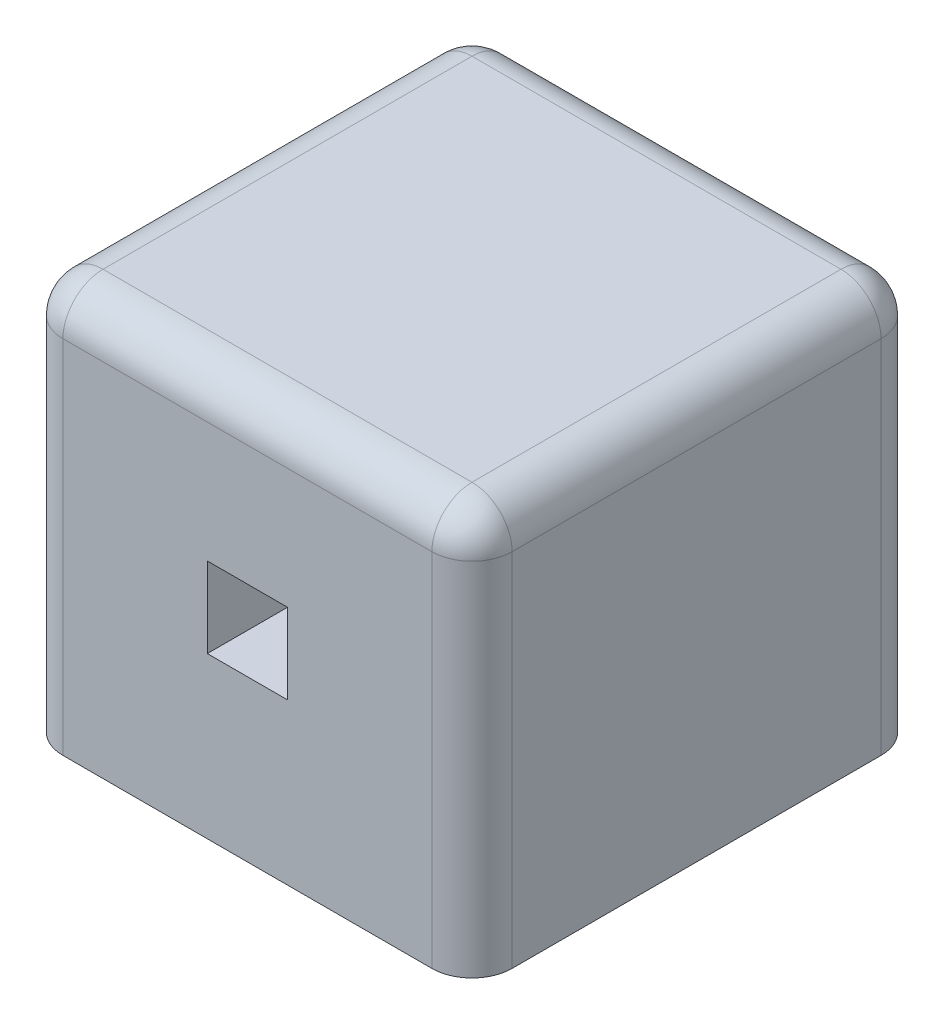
SolidWorks part; units mm, degrees
ref_plane "Front Plane" through (0, 0, 0) normal (0, 0, 1) x (1, 0, 0)
ref_plane "Top Plane" through (0, 0, 0) normal (0, 1, 0) x (1, 0, 0)
ref_plane "Right Plane" through (0, 0, 0) normal (1, 0, 0) x (0, 0, -1)
sketch "Sketch1" plane through (0, 0, 0) normal (0, 0, 1) x (1, 0, 0)
  line L0 (0, 35.7143) -> (0, -603.321) construction
  line L1 (40, -35.7143) -> (-40, -35.7143)
  line L2 (40, -35.7143) -> (40, 35.7143)
  line L3 (40, 35.7143) -> (-40, 35.7143)
  line L4 (-40, -35.7143) -> (-40, 35.7143)
  line L5 (40, -35.7143) -> (-40, 35.7143) construction
  line L6 (40, 35.7143) -> (-40, -35.7143) construction
  line L7 (-40, 0) -> (40, 0) construction
  line L9 (7.1429, -7.1429) -> (-7.1429, -7.1429)
  line L10 (7.1429, -7.1429) -> (7.1429, 7.1429)
  line L11 (7.1429, 7.1429) -> (-7.1429, 7.1429)
  line L12 (-7.1429, -7.1429) -> (-7.1429, 7.1429)
  line L13 (7.1429, -7.1429) -> (-7.1429, 7.1429) construction
  line L14 (7.1429, 7.1429) -> (-7.1429, -7.1429) construction
  point P0 (0, 0)
  point P10 (0, 0)
  dimension "D3" = 14.2857
  dimension "D1" = 71.4286
  dimension "D2" = 80
  dimension "D4" = 14.2857
extrude "Boss-Extrude1" add sketch "Sketch1" along normal blind 80
fillet "Fillet2" radius 7.1429 8 edges at (-40, 0, 80) (40, 0, 80) (0, 35.7143, 80) (40, 35.7143, 40) (-40, 35.7143, 40) (40, 0, 0) (0, 35.7143, 0) (-40, 0, 0)
sketch "Sketch3" plane through (0, -35.7143, 0) normal (0, -1, 0) x (1, 0, 0)
  line L0 (0, 80) -> (0, 0) construction
  line L1 (-32.8571, 80) -> (32.8571, 80) construction
  line L2 (-32.8571, 0) -> (32.8571, 0) construction
  line L3 (0, 40) -> (40, 40) construction
  line L4 (40, 72.8571) -> (40, 7.1429) construction
  circle A0 centre (0, 40) radius 5
  dimension "D1" = 10
extrude "Boss-Extrude6" add sketch "Sketch3" along normal blind 6
